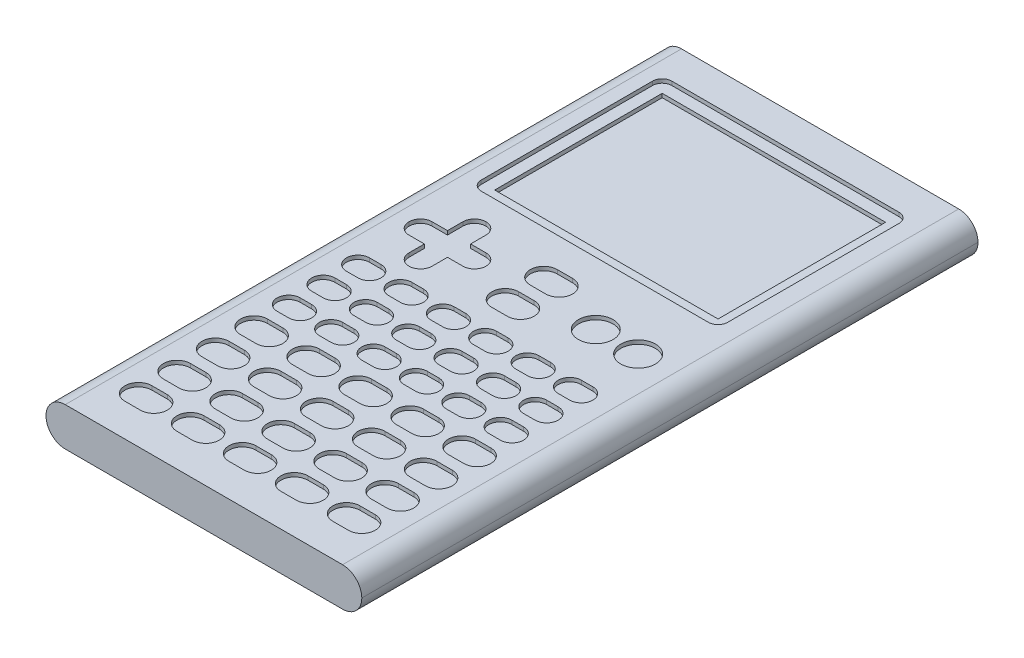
SolidWorks part; units mm, degrees
ref_plane "Plan de face" through (0, 0, 0) normal (0, 0, 1) x (1, 0, 0)
ref_plane "Plan de dessus" through (0, 0, 0) normal (0, 1, 0) x (1, 0, 0)
ref_plane "Plan de droite" through (0, 0, 0) normal (1, 0, 0) x (0, 0, -1)
sketch "Esquisse1" plane through (0, 0, 0) normal (0, 1, 0) x (1, 0, 0)
  line L1 (0, 0) -> (82, 0)
  line L2 (0, 0) -> (0, 160)
  line L3 (0, 160) -> (82, 160)
  line L4 (82, 0) -> (82, 160)
  dimension "D1" = 160
  dimension "D2" = 82
extrude "Boss.-Extru.1" add sketch "Esquisse1" along normal blind 10
fillet "Congé1" radius 5 4 edges at (82, 0, -80) (82, 10, -80) (0, 0, -80) (0, 10, -80)
sketch "Esquisse2" plane through (0, 10, 0) normal (0, 1, 0) x (1, 0, 0)
  line L0 (12, 12) -> (16, 12) construction
  line L1 (12, 15.5) -> (16, 15.5)
  line L2 (12, 8.5) -> (16, 8.5)
  arc A0 (12, 15.5) -> (12, 8.5) centre (12, 12) ccw
  arc A1 (16, 8.5) -> (16, 15.5) centre (16, 12) ccw
  point P2 (14, 12)
  dimension "D1" = 3.5
  dimension "D2" = 4
  dimension "D3" = 12
  dimension "D4" = 12
extrude "Enlèv. mat.-Extru.1" cut sketch "Esquisse2" against normal blind 1
pattern_linear "Répétition linéaire1" count 5 spacing 13.5 along (1, 0, 0) count 4 spacing 10 along (0, 0, -1) of "Enlèv. mat.-Extru.1"
sketch "Esquisse3" plane through (0, 10, 0) normal (0, 1, 0) x (1, 0, 0)
  line L0 (11.5, 51.5) -> (14.5, 51.5) construction
  line L1 (11.5, 54.5) -> (14.5, 54.5)
  line L2 (11.5, 48.5) -> (14.5, 48.5)
  line L3 (8.5, 42) -> (8.5, 61.8508) construction
  line L4 (16, 45.5) -> (12, 45.5) construction
  arc A0 (11.5, 54.5) -> (11.5, 48.5) centre (11.5, 51.5) ccw
  arc A1 (14.5, 48.5) -> (14.5, 54.5) centre (14.5, 51.5) ccw
  arc A3 (12, 45.5) -> (12, 38.5) centre (12, 42) ccw construction
  point P2 (13, 51.5)
  dimension "D1" = 3
  dimension "D3" = 3
  dimension "D2" = 3
extrude "Enlèv. mat.-Extru.2" cut sketch "Esquisse3" against normal blind 1
pattern_linear "Répétition linéaire2" count 6 spacing 11 along (1, 0, 0) count 3 spacing 9 along (0, 0, -1) of "Enlèv. mat.-Extru.2"
sketch "Esquisse4" plane through (0, 10, 0) normal (0, 1, 0) x (1, 0, 0)
  line L0 (77, 160) -> (5, 160) construction
  line L1 (8.5, 151.5) -> (72.5, 151.5)
  line L2 (8.5, 151.5) -> (8.5, 102)
  line L3 (8.5, 102) -> (72.5, 102)
  line L4 (72.5, 151.5) -> (72.5, 102)
  line L6 (8.5, 69.5) -> (8.5, 194.4678) construction
  line L7 (72.5, 69.5) -> (72.5, 187.1939) construction
  arc A0 (11.5, 72.5) -> (11.5, 66.5) centre (11.5, 69.5) ccw construction
  arc A1 (69.5, 66.5) -> (69.5, 72.5) centre (69.5, 69.5) ccw construction
  dimension "D2" = 49.5
  dimension "D3" = 8.5
extrude "Enlèv. mat.-Extru.3" cut sketch "Esquisse4" against normal blind 1
fillet "Congé2" radius 2.5 4 edges at (8.5, 9.5, -102) (72.5, 9.5, -102) (72.5, 9.5, -151.5) (8.5, 9.5, -151.5)
sketch "Esquisse5" plane through (0, 9, 0) normal (0, 1, 0) x (1, 0, 0)
  line L1 (11.5, 148.5) -> (69.5, 148.5)
  line L2 (11.5, 148.5) -> (11.5, 105)
  line L3 (11.5, 105) -> (69.5, 105)
  line L4 (69.5, 148.5) -> (69.5, 105)
  line L6 (8.5, 126.75) -> (74.5719, 126.75) construction
  line L7 (8.5, 149) -> (8.5, 104.5) construction
  line L8 (40.5, 151.5) -> (40.5, 102) construction
  line L9 (70, 151.5) -> (11, 151.5) construction
  line L10 (11, 102) -> (70, 102) construction
  line L11 (11.5, 105) -> (69.5, 148.5) construction
  line L12 (11.5, 148.5) -> (69.5, 105) construction
  point P14 (40.5, 126.75)
  point P15 (40.5, 126.75)
  dimension "D1" = 58
  dimension "D2" = 43.5
extrude "Enlèv. mat.-Extru.4" cut sketch "Esquisse5" against normal blind 1
sketch "Esquisse6" plane through (0, 10, 0) normal (0, 1, 0) x (1, 0, 0)
  line L0 (72.5, 69.5) -> (72.5, 99.6199) construction
  line L1 (8.5, 69.5) -> (8.5, 94.9544) construction
  line L2 (72.5, 85.75) -> (8.5, 85.75) construction
  line L3 (69.5, 72.5) -> (66.5, 72.5) construction
  line L4 (40.5, 96.0232) -> (40.5, 72.4234) construction
  line L5 (38.5, 90.75) -> (42.5, 90.75) construction
  line L6 (38.5, 94.25) -> (42.5, 94.25)
  line L7 (38.5, 87.25) -> (42.5, 87.25)
  line L8 (38.5, 80.75) -> (42.5, 80.75) construction
  line L9 (38.5, 77.25) -> (42.5, 77.25)
  line L10 (38.5, 84.25) -> (42.5, 84.25)
  line L11 (8.5, 88.75) -> (15.5, 88.75)
  line L12 (15.5, 88.75) -> (15.5, 95.75)
  line L13 (21.5, 95.75) -> (21.5, 88.75)
  line L14 (21.5, 88.75) -> (28.5, 88.75)
  line L15 (28.5, 88.75) -> (28.5, 82.75)
  line L16 (28.5, 82.75) -> (21.5, 82.75)
  line L17 (21.5, 82.75) -> (21.5, 75.75)
  line L18 (21.5, 75.75) -> (15.5, 75.75)
  line L19 (15.5, 75.75) -> (15.5, 82.75)
  line L20 (15.5, 82.75) -> (8.5, 82.75)
  line L21 (8.5, 82.75) -> (8.5, 88.75)
  line L22 (15.5, 95.75) -> (21.5, 95.75)
  line L23 (15.5, 82.75) -> (21.5, 88.75) construction
  line L24 (15.5, 88.75) -> (21.5, 82.75) construction
  circle A0 centre (68, 85.75) radius 4.5
  arc A1 (69.5, 66.5) -> (69.5, 72.5) centre (69.5, 69.5) ccw construction
  arc A2 (11.5, 72.5) -> (11.5, 66.5) centre (11.5, 69.5) ccw construction
  circle A3 centre (57, 85.75) radius 4.5
  arc A4 (38.5, 94.25) -> (38.5, 87.25) centre (38.5, 90.75) ccw
  arc A5 (42.5, 87.25) -> (42.5, 94.25) centre (42.5, 90.75) ccw
  arc A6 (38.5, 77.25) -> (38.5, 84.25) centre (38.5, 80.75) cw
  arc A7 (42.5, 84.25) -> (42.5, 77.25) centre (42.5, 80.75) cw
  point P14 (68, 72.5)
  point P19 (40.5, 85.75)
  point P24 (40.5, 90.75)
  point P31 (40.5, 80.75)
  point P39 (18.5, 85.75)
  dimension "D1" = 9
  dimension "D3" = 9
  dimension "D6" = 3.5
  dimension "D2" = 13.25
  dimension "D4" = 11
  dimension "D5" = 4
  dimension "D7" = 1.5
  dimension "D8" = 20
  dimension "D9" = 20
  dimension "D10" = 6
  dimension "D11" = 6
  dimension "D12" = 10
  dimension "D13" = 10
extrude "Enlèv. mat.-Extru.5" cut sketch "Esquisse6" against normal blind 1
fillet "Congé3" radius 3 8 edges at (21.5, 9.5, -75.75) (15.5, 9.5, -75.75) (8.5, 9.5, -82.75) (8.5, 9.5, -88.75) (28.5, 9.5, -82.75) (28.5, 9.5, -88.75) (21.5, 9.5, -95.75) (15.5, 9.5, -95.75)
